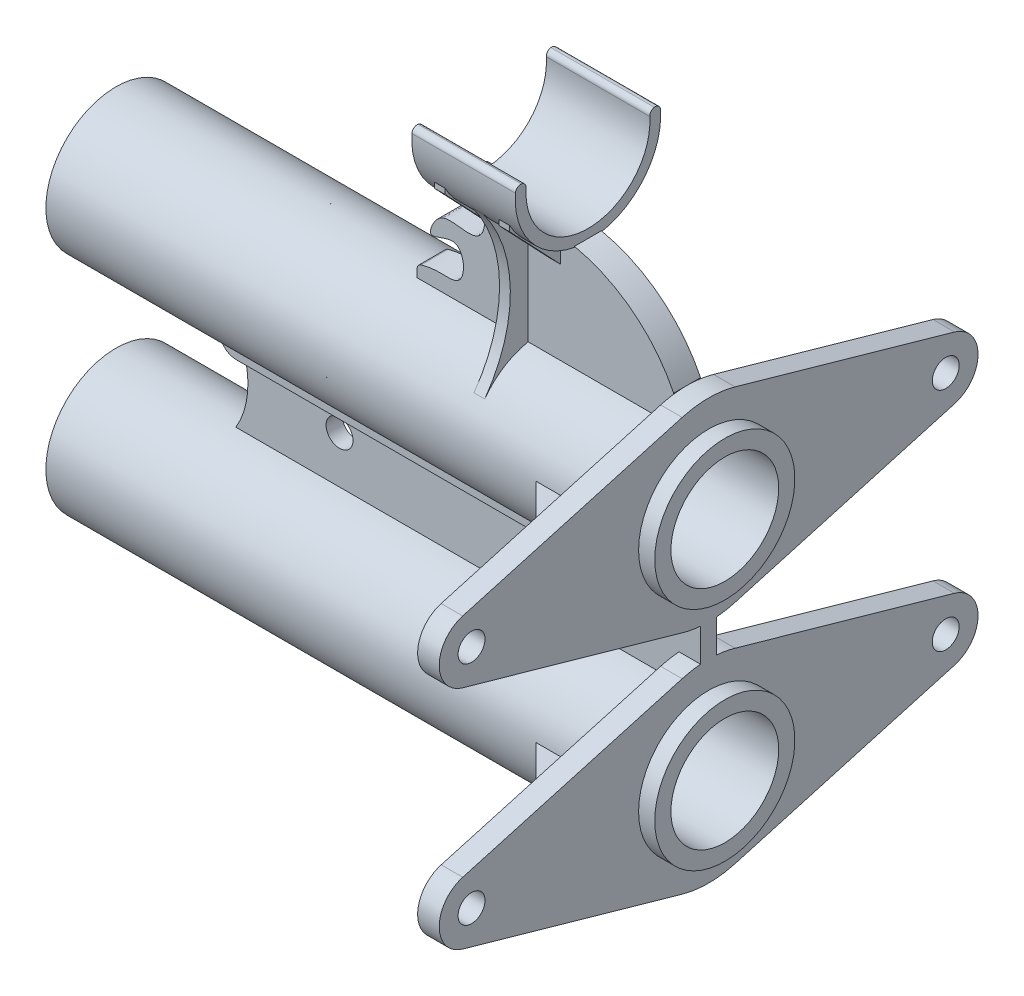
SolidWorks part; units mm, degrees
ref_plane "Front" through (0, 0, 0) normal (0, 0, 1) x (1, 0, 0)
ref_plane "Top" through (0, 0, 0) normal (0, 1, 0) x (1, 0, 0)
ref_plane "Right" through (0, 0, 0) normal (1, 0, 0) x (0, 0, -1)
sketch "Sketch1" plane through (0, 0, 0) normal (1, 0, 0) x (0, 0, -1)
  circle A0 centre (0, 0) radius 8.255
  dimension "D1" = 16.51
extrude "Base-Extrude" add sketch "Sketch1" against normal blind 69.85
sketch "Sketch2" plane through (0, 0, 0) normal (1, 0, 0) x (0, 0, -1)
  line L0 (27.94, 0) -> (-27.94, 0) construction
  line L1 (-28.9791, 3.6656) -> (-3.1173, 10.9967)
  line L2 (3.1173, 10.9967) -> (28.9791, 3.6656)
  line L3 (28.9791, -3.6656) -> (3.1173, -10.9967)
  line L4 (-28.9791, -3.6656) -> (-3.1173, -10.9967)
  arc A0 (-28.9791, 3.6656) -> (-28.9791, -3.6656) centre (-27.94, 0) ccw
  circle A1 centre (0, 0) radius 11.43
  arc A2 (-3.1173, -10.9967) -> (3.1173, -10.9967) centre (0, 0) ccw
  arc A3 (28.9791, -3.6656) -> (28.9791, 3.6656) centre (27.94, 0) ccw
  arc A4 (3.1173, 10.9967) -> (-3.1173, 10.9967) centre (0, 0) ccw
  circle A5 centre (-27.94, 0) radius 1.5875
  circle A6 centre (27.94, 0) radius 1.5875
  dimension "D2" = 7.62
  dimension "D4" = 3.175
  dimension "D3" = 63.5
  dimension "D1" = 3.175
extrude "Boss-Extrude1" add sketch "Sketch2" against normal blind 2.54
sketch "Sketch3" plane through (-69.85, 0, 0) normal (-1, 0, 0) x (0, 0, 1)
  circle A1 centre (0, 0) radius 6.35
  circle A2 centre (0, 0) radius 6.35
  dimension "D1" = 1.905
extrude "Cut-Extrude1" cut sketch "Sketch3" against normal through all
sketch "Sketch4" plane through (0, 0, 0) normal (1, 0, 0) x (0, 0, -1)
  circle A0 centre (0, 0) radius 6.35 construction
  circle A1 centre (0, 0) radius 8.255
  circle A2 centre (0, 0) radius 8.255
  circle A3 centre (0, 0) radius 6.35
  dimension "D1" = 1.905
extrude "Boss-Extrude2" add sketch "Sketch4" along normal blind 1.905
sketch "Sketch6" plane through (0, 0, 0) normal (0, 1, 0) x (1, 0, 0)
  line L0 (-2.54, 7.3025) -> (-13.0175, 7.3025)
  line L1 (-2.54, 7.3025) -> (-2.54, 17.78)
  line L2 (-2.54, 8.255) -> (-69.85, 8.255) construction
  line L4 (-2.54, 3.1173) -> (-2.54, 28.9791) construction
  line L5 (-13.0175, 7.3025) -> (-2.54, 17.78)
  point P7 (-12.065, 8.255)
  dimension "D1" = 0.9525
  dimension "D2" = 9.525
  dimension "D3" = 9.525
extrude "Boss-Extrude4" add sketch "Sketch6" along normal mid plane 1.905
mirror "Mirror1" about plane through (0, 0, 0) normal (0, 0, 1) of "Boss-Extrude4"
sketch "Sketch5" plane through (0, 0, 0) normal (0, 0, 1) x (1, 0, 0)
  line L0 (0, 7.3025) -> (-55.372, 7.3025)
  line L1 (0, 7.3025) -> (0, 19.3675)
  line L2 (-55.372, 19.3675) -> (0, 19.3675)
  line L3 (-2.54, 8.255) -> (-69.85, 8.255) construction
  line L4 (0, 3.6656) -> (0, 10.9967) construction
  line L5 (-2.54, 8.255) -> (-69.85, 8.255) construction
  line L6 (-63.3105, 18.415) -> (7.5357, 18.415) construction
  arc A0 (-55.372, 7.3025) -> (-55.372, 19.3675) centre (-63.3105, 13.335) ccw
  circle A1 centre (-42.545, 13.7414) radius 1.5875
  circle A2 centre (-12.7, 13.7414) radius 1.5875
  dimension "D6" = 3.175
  dimension "D1" = 0.9525
  dimension "D2" = 53.34
  dimension "D3" = 55.372
  dimension "D4" = 0.9525
  dimension "D5" = 10.16
  dimension "D7" = 12.7
  dimension "D8" = 29.845
  dimension "D9" = 5.4864
extrude "Boss-Extrude3" add sketch "Sketch5" along normal mid plane 1.905
pattern_linear "LPattern1" count 2 spacing 26.67 along (0, 1, 0) of "Mirror1", "Boss-Extrude4", "Base-Extrude", "Boss-Extrude1", "Cut-Extrude1", "Boss-Extrude2"
sketch "Sketch7" plane through (0, 0, 0) normal (0, 0, 1) x (1, 0, 0)
  line L0 (-27.94, 47.625) -> (-17.78, 47.625)
  line L1 (-2.54, 34.925) -> (-69.85, 34.925) construction
  line L2 (-2.54, 30.3356) -> (-2.54, 37.6667) construction
  line L3 (-2.54, 33.9725) -> (-2.54, 38.1)
  line L4 (-32.766, 33.9725) -> (-32.766, 36.195)
  line L5 (0, 38.1) -> (-2.54, 38.1) construction
  line L6 (-2.54, 33.9725) -> (-69.85, 33.9725)
  line L7 (-2.54, 33.9725) -> (-32.766, 33.9725)
  line L9 (-32.766, 36.195) -> (-26.8787, 36.195) construction
  line L10 (-26.8787, 36.195) -> (-26.8787, 40.1872) construction
  line L11 (-26.8787, 40.1872) -> (-31.0804, 40.1872) construction
  line L12 (-30.1196, 42.4628) -> (-24.2323, 42.4628) construction
  line L13 (-24.2323, 42.4628) -> (-24.2323, 46.455) construction
  line L14 (-24.2323, 46.455) -> (-28.434, 46.455) construction
  line L15 (-28.434, 46.455) -> (-27.94, 47.625) construction
  line L16 (-30.1196, 42.4628) -> (-31.0804, 40.1872) construction
  arc A0 (-2.54, 38.1) -> (-17.78, 47.625) centre (-17.78, 30.6705) ccw
  point P21 (-40.9571, 58.7832)
  point P22 (-30.2595, 36.6329)
  point P23 (-27.8077, 42.44)
  point P24 (-28.3103, 46.7479)
  point P25 (-41.2611, 58.6616)
  point P26 (-27.7531, 37.0707)
  point P27 (-28.3605, 40.548)
  point P28 (-31.1325, 40.0637)
  point P29 (-30.3141, 42.0021)
  point P30 (0, 0)
  point P31 (-25.3012, 42.8778)
  point P32 (-25.9087, 46.3551)
  point P33 (-28.6806, 45.8708)
  dimension "D1" = 12.7
  dimension "D2" = 15.24
  dimension "D3" = 25.4
  dimension "D5" = 30.226
  dimension "D6" = 1.27
  dimension "D4" = 0.9525
extrude "Boss-Extrude5" add sketch "Sketch7" along normal mid plane 3.175
fillet "Fillet2" radius 0.635 4 edges at (-27.94, 47.625, 0) (-32.766, 36.195, 0)
ref_plane "Plane4" through (-20.32, 0, 0) normal (1, 0, 0) x (0, 0, -1)
sketch "Sketch8" plane through (-20.32, 0, 0) normal (1, 0, 0) x (0, 0, -1)
  line L0 (-10.4652, 56.8325) -> (5.9346, 56.8325) construction
  line L1 (-1.5875, 47.625) -> (1.5875, 47.625) construction
  arc A0 (-8.4779, 56.8325) -> (8.4779, 56.8325) centre (0, 55.5625) ccw
  dimension "D1" = 17.145
  dimension "D2" = 1.27
  dimension "D3" = 0.635
extrude "Boss-Extrude-Thin1" add sketch "Sketch8" along normal mid plane 12.192 thin
fillet "Fillet3" radius 0.635 8 edges at (-26.416, 56.7384, 7.8499) (-20.32, 56.6444, 7.2219) (-20.32, 56.8325, 8.4779) (-14.224, 56.7384, -7.8499) (-20.32, 56.8325, -8.4779) (-20.32, 56.6444, -7.2219) (-14.224, 56.7384, 7.8499) (-26.416, 56.7384, -7.8499)
sketch "Sketch9" plane through (-20.32, 0, 0) normal (1, 0, 0) x (0, 0, -1)
  line L1 (0, 50) -> (0, -50) construction
  line L2 (1.5875, 36.3205) -> (1.5875, 47.231) construction
  line L3 (1.5875, 34.7709) -> (1.5875, 47.1383)
  arc A0 (6.6998, 31.4926) -> (1.5875, 34.7709) centre (0, 26.67) ccw
  arc A1 (6.8677, 50.4319) -> (6.6998, 31.4926) centre (19.6968, 40.8478) ccw
  arc A2 (1.5875, 47.1383) -> (8.5523, 56.1502) centre (0, 55.5625) ccw construction
  circle A3 centre (0, 26.67) radius 8.255 construction
  arc A4 (1.5875, 47.1383) -> (6.8677, 50.4319) centre (0, 55.5625) ccw
  dimension "D1" = 3.683
extrude "Boss-Extrude6" add sketch "Sketch9" against normal mid plane 1.27
ref_plane "Plane5" through (-23.495, 0, 0) normal (-1, 0, 0) x (0, 0, 1)
sketch "Sketch10" plane through (-23.495, 0, 0) normal (-1, 0, 0) x (0, 0, 1)
  line L0 (-1.5875, 44.5983) -> (-7.5658, 50.8968)
  line L1 (-1.5875, 36.3205) -> (-1.5875, 47.231) construction
  line L2 (-7.5658, 50.8968) -> (-7.5658, 51.5318)
  line L3 (-1.5875, 34.7709) -> (-1.5875, 47.1383) construction
  line L4 (-1.5875, 44.5983) -> (-1.5875, 47.1383)
  arc A0 (-7.5658, 51.5318) -> (-1.5875, 47.1383) centre (0, 55.5625) ccw
  arc A1 (-8.5523, 56.1502) -> (-1.5875, 47.1383) centre (0, 55.5625) ccw construction
  arc A2 (-8.679, 56.1589) -> (-1.611, 47.0135) centre (0, 55.5625) ccw
  arc A3 (-8.679, 56.1589) -> (-0.154, 46.8644) centre (0, 55.5625) ccw construction
  dimension "D1" = 2.54
  dimension "D3" = 0.635
  dimension "D2" = 0.127
extrude "Boss-Extrude7" add sketch "Sketch10" along normal blind 1.27
mirror "Mirror2" about plane through (-20.32, 0, 0) normal (1, 0, 0) of "Boss-Extrude7"
sketch "Sketch11" plane through (-2.54, 0, 0) normal (-1, 0, 0) x (0, 0, 1)
  line L0 (-0.9525, 15.2798) -> (-0.9525, 18.4701) construction
  line L1 (-0.9525, 17.0203) -> (-0.9525, 18.4701)
  line L4 (-2.8575, 17.0203) -> (-0.9525, 17.0203)
  line L5 (-2.8575, 17.0203) -> (-2.8575, 18.9253)
  arc A0 (-8.1999, 25.7175) -> (-0.9525, 18.4701) centre (0, 26.67) ccw construction
  arc A1 (-2.8575, 18.9253) -> (-0.9525, 18.4701) centre (0, 26.67) ccw
  dimension "D1" = 1.905
  dimension "D2" = 1.905
extrude "Boss-Extrude8" add sketch "Sketch11" along normal up to surface (51.5061 mm away)
fillet "Fillet4" radius 1.905 1 edges at (-28.293, 17.0203, -2.8575)
mirror "Mirror3" about plane through (0, 0, 0) normal (0, 0, 1) of "Fillet4", "Boss-Extrude8", "Boss-Extrude6", "Boss-Extrude7", "Mirror2"
sketch "Sketch12" plane through (-69.85, 0, 0) normal (-1, 0, 0) x (0, 0, 1)
  point P0 (0, 26.67)
ref_plane "Plane6" through (0, 26.67, 0) normal (0, 1, 0) x (-1, 0, 0)
sketch "Sketch13" plane through (0, 0, 0) normal (0, 1, 0) x (1, 0, 0)
  line L1 (8.9026, 0) -> (-75.3942, 0)
  line L2 (8.9026, 0) -> (8.9026, -34.0886)
  line L3 (8.9026, -34.0886) -> (-75.3942, -34.0886)
  line L4 (-75.3942, 0) -> (-75.3942, -34.0886)
  line L5 (-69.85, 0) -> (-2.54, 0) construction
extrude "Cut-Extrude2" cut sketch "Sketch13" against normal through all and the other way through all
